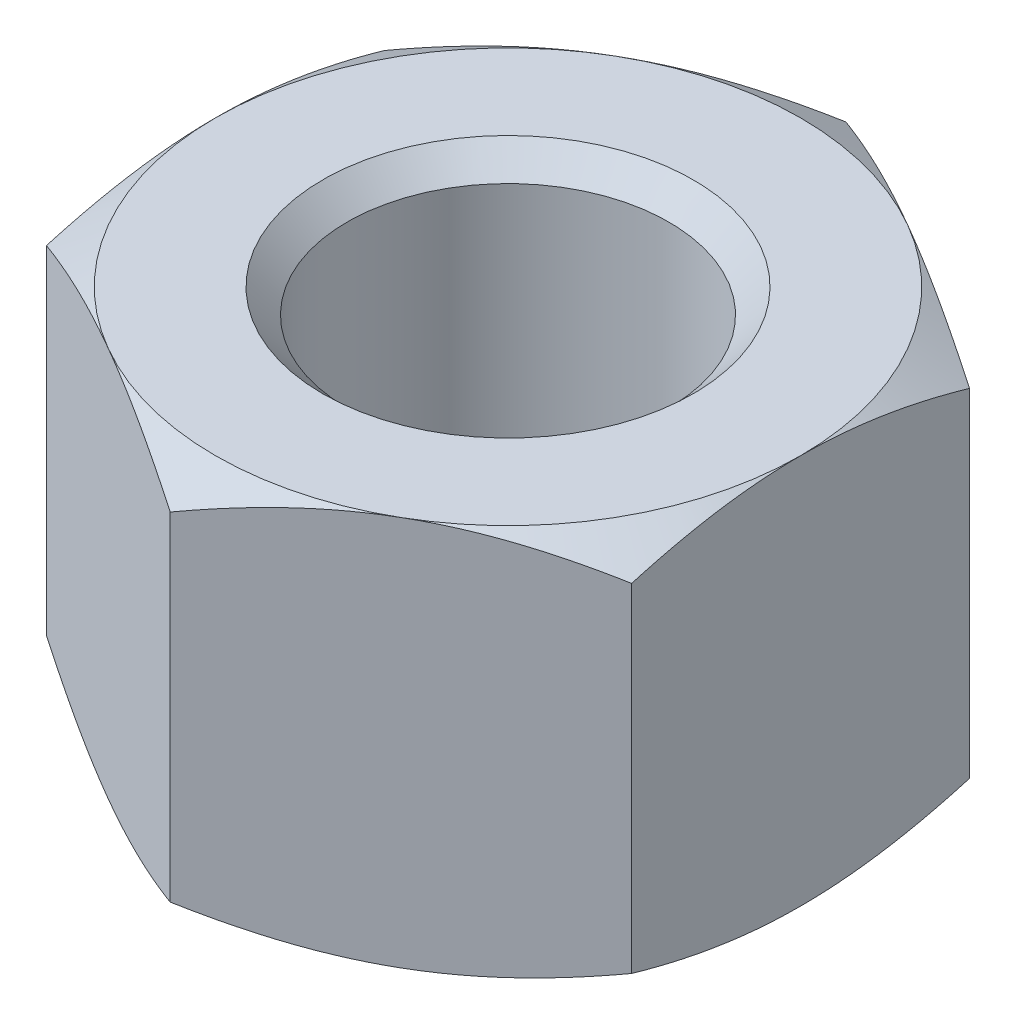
SolidWorks part; units mm, degrees
ref_plane "Front Plane" through (0, 0, 0) normal (0, 0, 1) x (1, 0, 0)
ref_plane "Top Plane" through (0, 0, 0) normal (0, 1, 0) x (1, 0, 0)
ref_plane "Right Plane" through (0, 0, 0) normal (1, 0, 0) x (0, 0, -1)
sketch "Sketch1" plane through (0, 0, 0) normal (0, 1, 0) x (1, 0, 0)
  line L1 (3, -1.7321) -> (3, 1.7321)
  line L2 (3, 1.7321) -> (0, 3.4641)
  line L3 (0, 3.4641) -> (-3, 1.7321)
  line L4 (-3, 1.7321) -> (-3, -1.7321)
  line L5 (-3, -1.7321) -> (0, -3.4641)
  line L6 (0, -3.4641) -> (3, -1.7321)
  circle A0 centre (0, 0) radius 3 construction
  dimension "D1" = 6
extrude "Boss-Extrude1" add sketch "Sketch1" along normal mid plane 4
sketch "Sketch2" plane through (0, 2, 0) normal (0, 1, 0) x (1, 0, 0)
  line L0 (3, 1.7321) -> (0, 3.4641) construction
  circle A0 centre (0, 0) radius 3
extrude "Cut-Extrude1" cut sketch "Sketch2" against normal blind 2.4 draft 60 flip side to cut
mirror "Mirror1" about plane through (0, 0, 0) normal (0, 1, 0) of "Cut-Extrude1"
hole_wizard " Tapped Hole1" positions "Sketch3" profile "Sketch4" tap size "M4" standard "ISO"
sketch "Sketch3" plane through (0, -2, 0) normal (0, -1, 0) x (-1, 0, 0)
  point P0 (0, 0)
sketch "Sketch4" plane through (0, -2, 0) normal (1, 0, 0) x (0, 0, -1)
  line L0 (0, 0) -> (0, 4)
  line L1 (0, 4) -> (1.65, 4)
  line L2 (1.65, 4) -> (1.65, 0)
  line L5 (1.65, 0) -> (0, 0)
  line L11 (0, -6.35) -> (0, 107.95) construction
  dimension "Thru Tap Drill Dia." = 3.3
  dimension "Thru Tap Drill Depth" = 4
chamfer "Chamfer1" distance 0.25 angle 45 2 edges at (0, 2, 1.65) (0, -2, -1.65)
